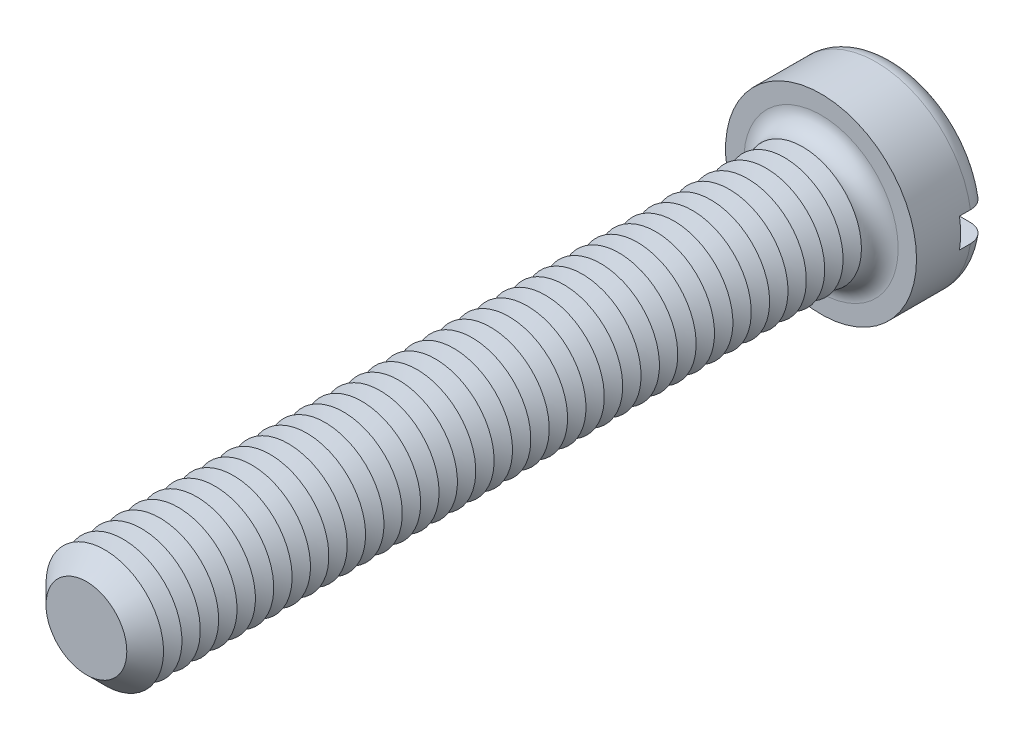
SolidWorks part; units mm, degrees
ref_plane "Front Plane" through (0, 0, 0) normal (0, 0, 1) x (1, 0, 0)
ref_plane "Top Plane" through (0, 0, 0) normal (0, 1, 0) x (1, 0, 0)
ref_plane "Right Plane" through (0, 0, 0) normal (1, 0, 0) x (0, 0, -1)
sketch "Sketch3" plane through (0, 0, 0) normal (0, 0, 1) x (1, 0, 0)
  circle A0 centre (0, 0) radius 6.5
  dimension "D1" = 13
extrude "Boss-Extrude2" add sketch "Sketch3" against normal blind 5
sketch "Sketch4" plane through (0, 0, 0) normal (0, 0, 1) x (1, 0, 0)
  circle A0 centre (0, 0) radius 4
  dimension "D1" = 8
extrude "Boss-Extrude3" add sketch "Sketch4" along normal blind 50
fillet "Fillet1" radius 1.25 2 edges at (6.5, 0, -5) (4, 0, 0)
chamfer "Chamfer1" distance 1.25 angle 45 1 edges at (4, 0, 50)
sketch "Sketch5" plane through (0, 0, 0) normal (1, 0, 0) x (0, 0, -1)
  line L0 (1.6944, 0) -> (-7.6738, 0) construction
sketch "Sketch6" plane through (0, 0, 0) normal (1, 0, 0) x (0, 0, -1)
  line L0 (-1.25, 4) -> (-1.875, 2.9175)
  line L1 (-1.875, 2.9175) -> (-2.5, 4)
  line L2 (-1.25, 4) -> (-48.75, 4) construction
  line L3 (-2.5, 4) -> (-1.25, 4)
  dimension "D1" = 1.25
revolve "Cut-Revolve1" cut sketch "Sketch6" angle 360 about L0
pattern_linear "LPattern1" count 38 spacing 1.25 along (0, 0, 1) of "Cut-Revolve1"
sketch "Sketch8" plane through (0, 0, -5) normal (0, 0, -1) x (-1, 0, 0)
  line L1 (6.5, -1) -> (-6.5, -1)
  line L2 (6.5, -1) -> (6.5, 1)
  line L3 (6.5, 1) -> (-6.5, 1)
  line L4 (-6.5, -1) -> (-6.5, 1)
  line L5 (6.5, -1) -> (-6.5, 1) construction
  line L6 (6.5, 1) -> (-6.5, -1) construction
  point P0 (0, 0)
  dimension "D1" = 13
  dimension "D2" = 2
extrude "Cut-Extrude1" cut sketch "Sketch8" against normal blind 2
